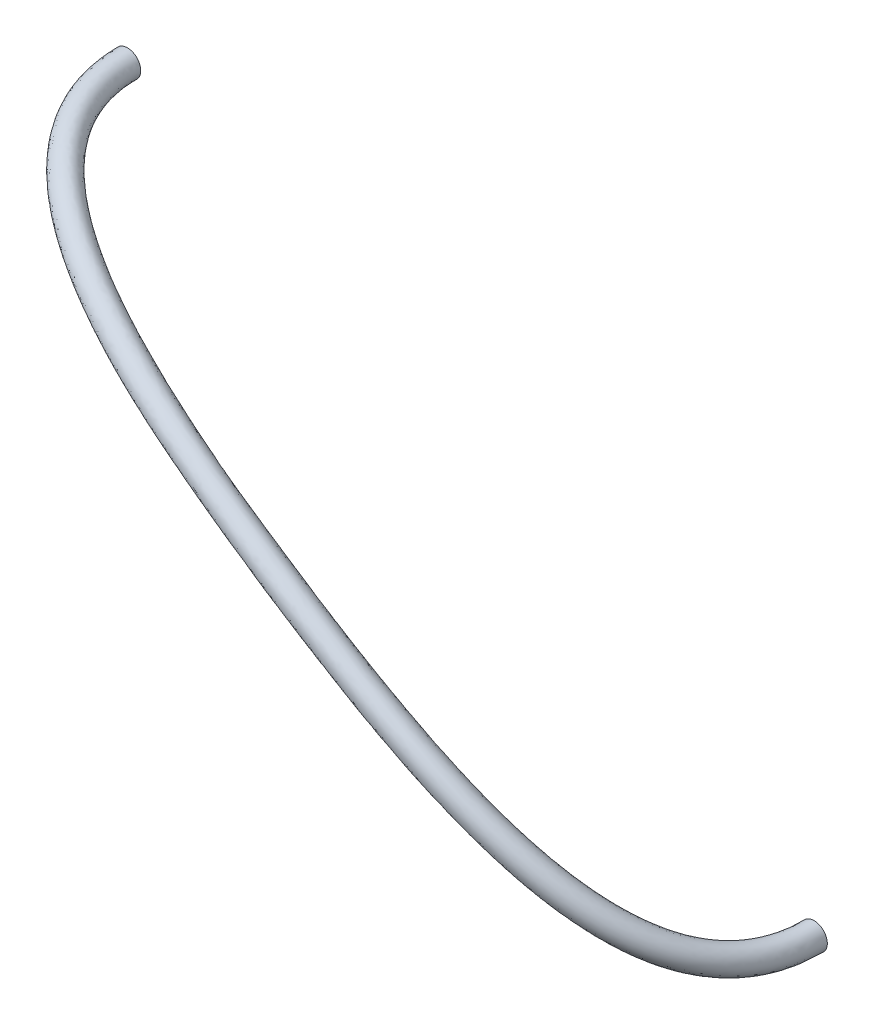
SolidWorks part; units mm, degrees
ref_plane "Front Plane" through (0, 0, 0) normal (0, 0, 1) x (1, 0, 0)
ref_plane "Top Plane" through (0, 0, 0) normal (0, 1, 0) x (1, 0, 0)
ref_plane "Right Plane" through (0, 0, 0) normal (1, 0, 0) x (0, 0, -1)
sketch3d "3DSketch1"
  line L0 (234.0655, 294.2607, 36.9534) -> (149.9296, 344.8146, 36.9534) construction
  line L1 (234.0655, 294.2607, 36.9534) -> (234.0655, 294.2607, 61.9534) construction
  line L2 (149.9296, 344.8146, 36.9534) -> (149.9296, 344.8146, 61.9534) construction
  line L3 (234.0655, 294.2607, 61.9534) -> (149.9296, 344.8146, 61.9534) construction
  line L4 (191.9976, 319.5376, 61.9534) -> (194.5728, 323.8235, 61.9534) construction
  arc A0 (234.1178, 297.2574, 36.9534) -> (231.4964, 295.8043, 36.9534) centre (234.0655, 294.2607, 36.9534) ccw construction
  circle A1 centre (149.9296, 344.8146, 36.9534) radius 1.7018 construction
  spline S0 degree 3 poles (234.0655, 294.2607, 36.9534) (234.0655, 294.2607, 57.5962) (197.148, 328.1093, 67.5754) (149.9296, 344.8146, 55.0665) (149.9296, 344.8146, 36.9534) knots 0 0 0 0 0.5 1 1 1 1
  point P0 (234.0655, 294.2607, 36.9534)
  point P4 (234.0655, 294.2607, 39.9506)
  point P5 (149.9296, 344.8146, 36.9534)
  point P9 (149.9296, 344.8146, 35.2516)
  dimension "D1" = 25
  dimension "D2" = 5
sketch "Sketch1" plane through (0, 0, 36.9534) normal (0, 0, 1) x (1, 0, 0)
  circle A0 centre (234.0655, 294.2607) radius 1.6256 construction
  circle A1 centre (234.0655, 294.2607) radius 1.6256
  circle A2 centre (234.0655, 294.2607) radius 0.7938
  dimension "D1" = 1.5875
sweep "Sweep1" add profiles "Sketch1" path "3DSketch1"
